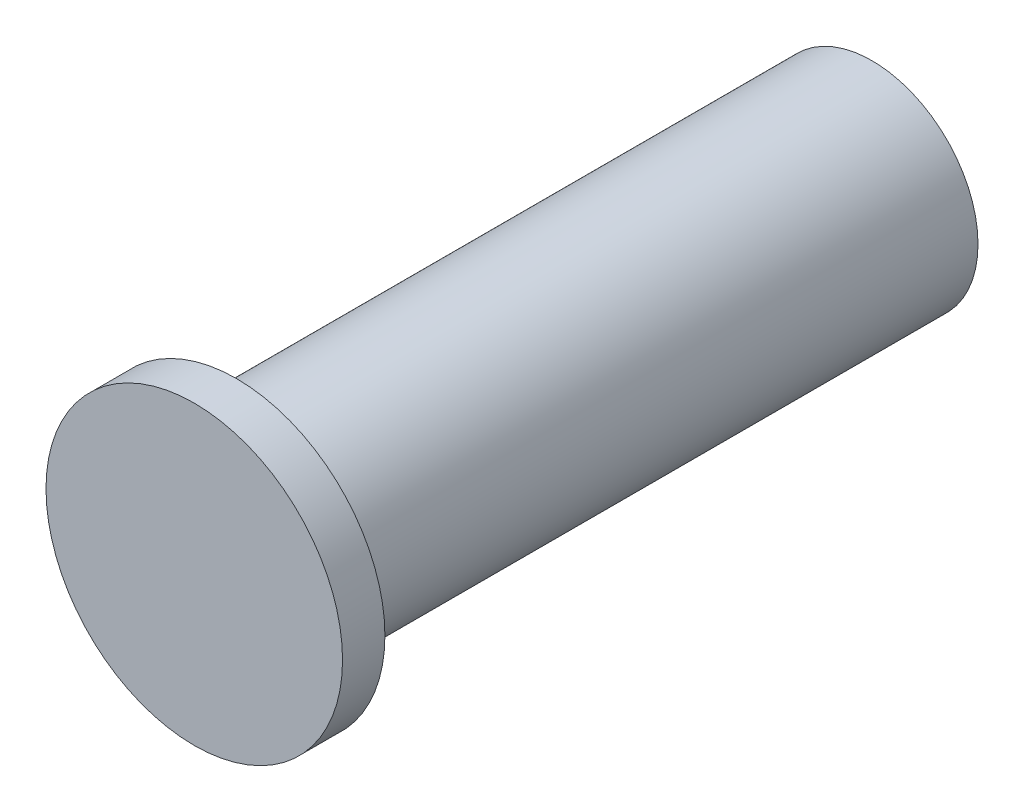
SolidWorks part; units mm, degrees
ref_plane "Front Plane" through (0, 0, 0) normal (0, 0, 1) x (1, 0, 0)
ref_plane "Top Plane" through (0, 0, 0) normal (0, 1, 0) x (1, 0, 0)
ref_plane "Right Plane" through (0, 0, 0) normal (1, 0, 0) x (0, 0, -1)
sketch "Sketch1" plane through (0, 0, 0) normal (0, 0, 1) x (1, 0, 0)
  circle A0 centre (0, 0) radius 1.27
extrude "Boss-Extrude1" add sketch "Sketch1" against normal blind 7.62
sketch "Sketch2" plane through (0, 0, 0) normal (0, 0, 1) x (1, 0, 0)
  circle A0 centre (0, 0) radius 1.778
extrude "Boss-Extrude2" add sketch "Sketch2" along normal blind 0.508
